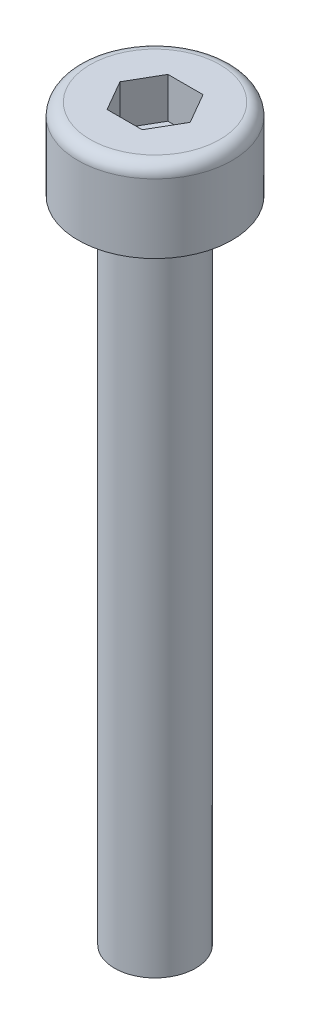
SolidWorks part; units mm, degrees
ref_plane "Aufriss" through (0, 0, 0) normal (0, 0, 1) x (1, 0, 0)
ref_plane "Grundriss" through (0, 0, 0) normal (0, 1, 0) x (1, 0, 0)
ref_plane "Seitenriss" through (0, 0, 0) normal (1, 0, 0) x (0, 0, -1)
sketch "Skizze1" plane through (0, 0, 0) normal (0, 0, 1) x (1, 0, 0)
  line L0 (0, 0) -> (-1, 0)
  line L1 (-1, 0) -> (-1, 16)
  line L2 (-1, 16) -> (-1.9, 16)
  line L3 (-1.9, 16) -> (-1.9, 17.7)
  line L4 (-1.6, 18) -> (0, 18)
  line L5 (0, 0) -> (0, 18) construction
  line L6 (0, 0) -> (0, 18)
  arc A0 (-1.9, 17.7) -> (-1.6, 18) centre (-1.6, 17.7) cw
  dimension "D1" = 2
  dimension "D5" = 0.3
  dimension "D2" = 3.8
  dimension "D3" = 16
  dimension "D4" = 2
revolve "Rotation1" add sketch "Skizze1" angle 360 about L5
sketch "Skizze2" plane through (0, 18, 0) normal (0, 1, 0) x (1, 0, 0)
  line L1 (0.433, 0.75) -> (-0.433, 0.75)
  line L2 (-0.433, 0.75) -> (-0.866, 0)
  line L3 (-0.866, 0) -> (-0.433, -0.75)
  line L4 (-0.433, -0.75) -> (0.433, -0.75)
  line L5 (0.433, -0.75) -> (0.866, 0)
  line L6 (0.866, 0) -> (0.433, 0.75)
  circle A0 centre (0, 0) radius 0.75 construction
  dimension "D1" = 1.5
extrude "Schnitt-Linear austragen1" cut sketch "Skizze2" against normal blind 1
